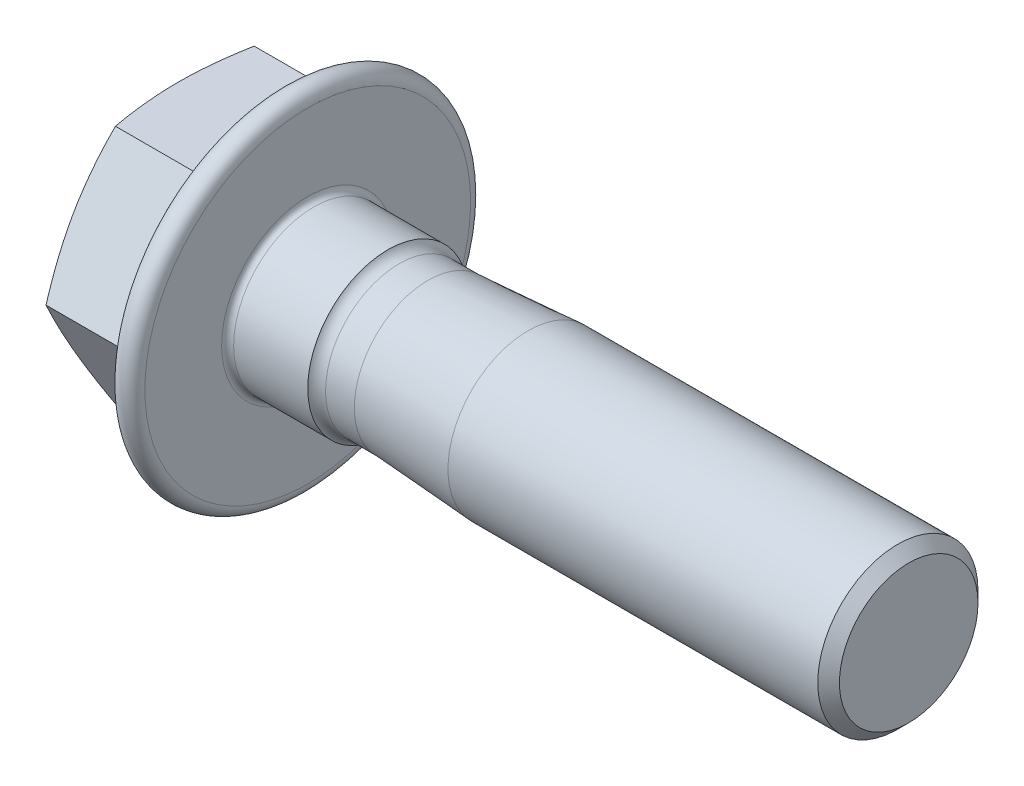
SolidWorks part; units mm, degrees
ref_plane "Front" through (0, 0, 0) normal (0, 0, 1) x (1, 0, 0)
ref_plane "Top" through (0, 0, 0) normal (0, 1, 0) x (1, 0, 0)
ref_plane "Right" through (0, 0, 0) normal (1, 0, 0) x (0, 0, -1)
sketch "Sketch1" plane through (0, 0, 0) normal (1, 0, 0) x (0, 0, -1)
  line L1 (13.8564, 0) -> (6.9282, 12)
  line L2 (6.9282, 12) -> (-6.9282, 12)
  line L3 (-6.9282, 12) -> (-13.8564, 0)
  line L4 (-13.8564, 0) -> (-6.9282, -12)
  line L5 (-6.9282, -12) -> (6.9282, -12)
  line L6 (6.9282, -12) -> (13.8564, 0)
  circle A0 centre (0, 0) radius 12 construction
  dimension "s" = 24
extrude "BaseHead" add sketch "Sketch1" along normal blind 14.1
sketch "Sketch2" plane through (14.1, 0, 0) normal (1, 0, 0) x (0, 0, -1)
  circle A0 centre (0, 0) radius 8
  dimension "d" = 16
extrude "BaseBody" add sketch "Sketch2" along normal blind 60
sketch "Sketch3" plane through (2.9494, 0, 2.8241) normal (0, 1, 0) x (0, 0, -1)
  line L0 (16.6805, 2.9494) -> (16.6805, 1.1272)
  line L2 (16.6805, 1.1272) -> (11.6741, 2.9494)
  line L4 (11.6741, 2.9494) -> (16.6805, 2.9494)
  line L5 (2.8241, 3.9387) -> (2.8241, 2.4525) construction
  dimension "D1" = 20
  dimension "da" = 17.7
revolve "HeadChamfer" cut sketch "Sketch3" angle 360 about L5
sketch "Sketch5" plane through (-0.1752, 0, 7.2752) normal (0, 1, 0) x (0, 0, -1)
  line L0 (7.2752, -14.2752) -> (7.2752, -7.1738) construction
  line L1 (7.2752, -74.2752) -> (7.2752, -14.2752) construction
  line L2 (7.2752, -14.2752) -> (23.5378, -14.2752)
  line L3 (23.961, -11.8752) -> (7.2752, -5.802)
  line L4 (7.2752, -5.802) -> (7.2752, -14.2752)
  line L5 (21.1316, -14.2752) -> (14.2034, -14.2752) construction
  arc A0 (23.5378, -14.2752) -> (23.961, -11.8752) centre (23.5378, -13.0378) ccw
  dimension "D3" = 20
  dimension "c" = 2.4
  dimension "dc" = 35
revolve "Flange" add sketch "Sketch5" angle 360 about L0
fillet "HeadFillet" radius 0.6 1 edges at (14.1, 0, 8)
fillet "FlangeHexFillet" radius 1 6 edges
chamfer "Chamfer1" distance 1.0825 angle 45 1 edges at (74.1, 0, -8)
sketch "Sketch6" plane through (-28.3278, 0, -3) normal (0, 1, 0) x (-1, 0, 0)
  line L0 (-50.4278, 11) -> (-50.4278, 10.3505)
  line L1 (-42.4278, 19.2627) -> (-42.4278, -13.2627) construction
  line L2 (-50.4278, 10.3505) -> (-54.4278, 10.3505)
  line L3 (-54.4278, 10.3505) -> (-64.4278, 11)
  line L4 (-64.4278, 11) -> (-50.4278, 11)
  line L5 (-43.0278, 11) -> (-101.3453, 11) construction
  line L6 (-48.9486, 3) -> (-26.9469, 3) construction
  line L7 (-101.3453, 3) -> (-43.0278, 3) construction
  dimension "1d" = 8
  dimension "ls" = 12
  dimension "lg" = 22
  dimension "dr" = 14.701
revolve "Cut-Revolve1" cut sketch "Sketch6" angle 360 about L6
fillet "Fillet1" radius 1.299 1 edges at (22.1, 0, -7.3505)
equation "\"D1@Chamfer1\" =  ( \"d@Sketch2\" - \"D2@ThreadCosmetic1\" ) / 2"
equation "\"1d@Sketch6\" = \"d@Sketch2\"*0.5"
equation "\"D1@Fillet1\"=(\"d@Sketch2\"-\"dr@Sketch6\")"
